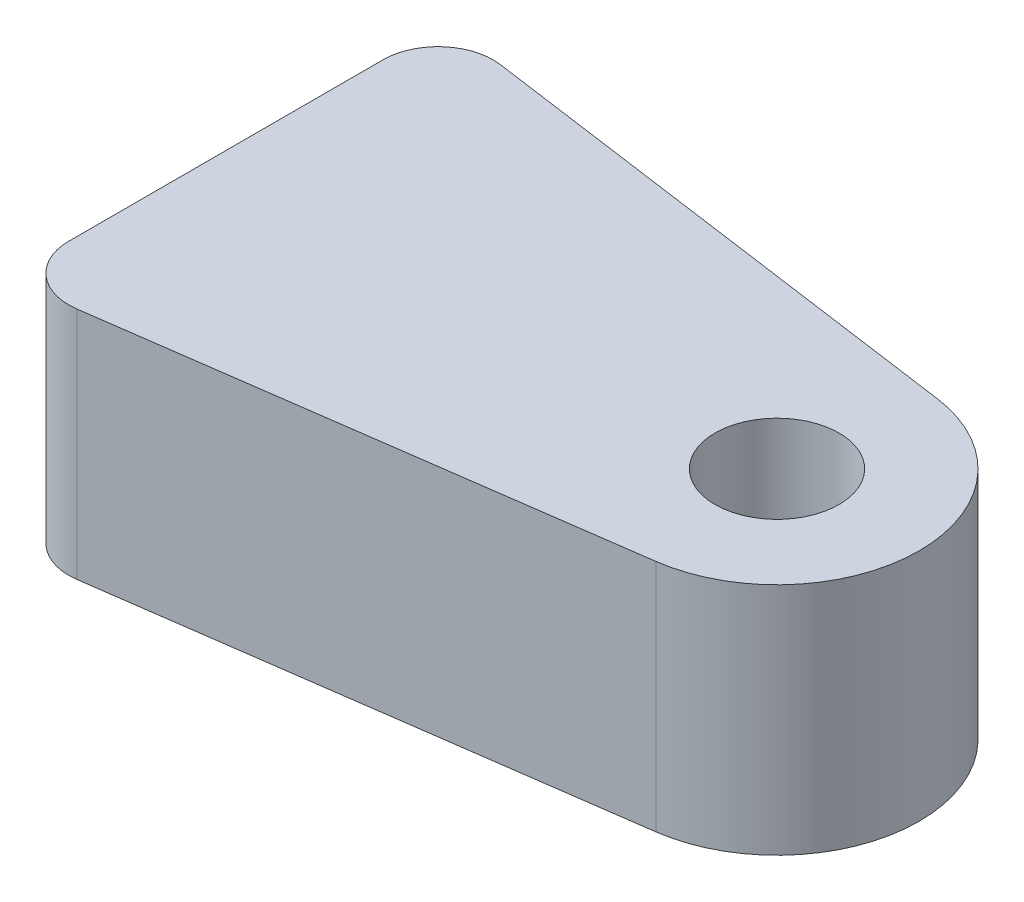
SolidWorks part; units mm, degrees
ref_plane "Plan de face" through (0, 0, 0) normal (0, 0, 1) x (1, 0, 0)
ref_plane "Plan de dessus" through (0, 0, 0) normal (0, 1, 0) x (1, 0, 0)
ref_plane "Plan de droite" through (0, 0, 0) normal (1, 0, 0) x (0, 0, -1)
sketch "Esquisse1" plane through (0, 0, 0) normal (0, 1, 0) x (1, 0, 0)
  circle A0 centre (0, 0) radius 2.45
  circle A1 centre (0, 0) radius 5.158
  dimension "D1" = 4.9
extrude "Boss.-Extru.1" add sketch "Esquisse1" along normal blind 2.5
sketch "Esquisse2" plane through (0, 2.5, 0) normal (0, 1, 0) x (1, 0, 0)
  circle A0 centre (0, 0) radius 5.158
  circle A1 centre (0, 0) radius 1
  dimension "D1" = 2
extrude "Boss.-Extru.2" add sketch "Esquisse2" along normal blind 6
sketch "Esquisse3" plane through (0, 8.5, 0) normal (0, 1, 0) x (1, 0, 0)
  circle A0 centre (0, 0) radius 2.25
  dimension "D1" = 4.5
extrude "Enlèv. mat.-Extru.1" cut sketch "Esquisse3" against normal blind 4.5
sketch "Esquisse4" plane through (0, 0, 0) normal (0, 1, 0) x (1, 0, 0)
  line L0 (0.7131, 5.1085) -> (-20, 8)
  line L1 (-20, 8) -> (-20, -8)
  line L2 (-20, -8) -> (0.7131, -5.1085)
  line L3 (0.7131, 5.1085) -> (-2.6848, 1.6893)
  line L4 (-2.6848, 1.6893) -> (-2.6848, -2.736)
  line L5 (-2.6848, -2.736) -> (0.7131, -5.1085)
  circle A0 centre (0, 0) radius 5.158 construction
  circle A1 centre (0, 0) radius 1 construction
  dimension "D1" = 20
  dimension "D2" = 16
extrude "Boss.-Extru.3" add sketch "Esquisse4" along normal blind 8.5
fillet "Congé1" radius 2 2 edges at (-20, 4.25, 8) (-20, 4.25, -8)
